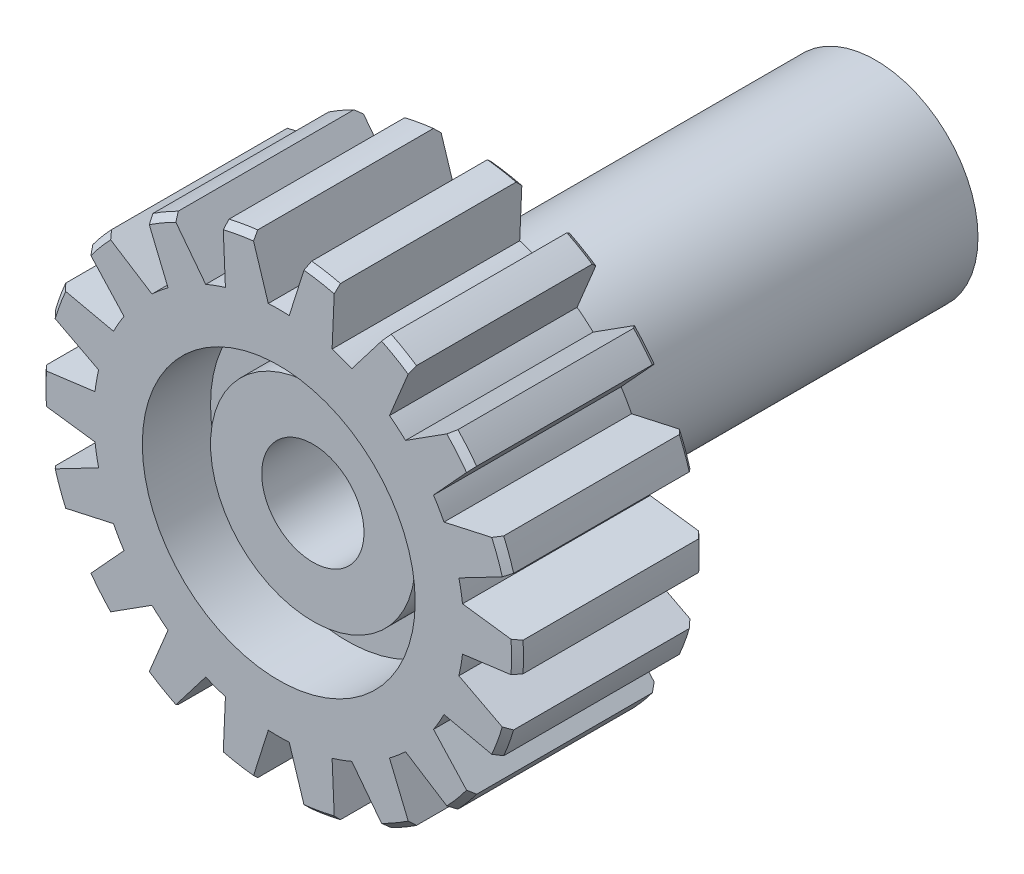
SolidWorks part; units mm, degrees
ref_plane "Plan1" through (0, 0, 0) normal (0, 0, 1) x (1, 0, 0)
ref_plane "Plan2" through (0, 0, 0) normal (0, 1, 0) x (1, 0, 0)
ref_plane "Plan3" through (0, 0, 0) normal (1, 0, 0) x (0, 0, -1)
sketch "Diamètre primitif" plane through (0, 0, 0) normal (0, 0, 1) x (1, 0, 0)
  line L0 (0, 0) -> (0.7, 0) construction
  circle A0 centre (0, 0) radius 6.3
  point P3 (0, 0)
  dimension "D1" = 12.6
  dimension "D2" = 0.7
sketch "Esquisse2" plane through (0, 0, 0) normal (0, 0, 1) x (1, 0, 0)
  circle A0 centre (0, 0) radius 7
  dimension "D1" = 14
extrude "Diamètre de tête" add sketch "Esquisse2" along normal mid plane 5.5
chamfer "Chanfreins" distance 0.175 angle 45
sketch "Esquisse3" plane through (0, 0, 0) normal (0, 0, 1) x (1, 0, 0)
  line L0 (0, 0) -> (0, 7) construction
  line L1 (-0.3072, 5.4163) -> (-0.7924, 6.955)
  line L2 (0.3072, 5.4163) -> (0.7924, 6.955)
  arc A0 (0.3072, 5.4163) -> (-0.3072, 5.4163) centre (0, 0) ccw
  circle A1 centre (0, 0) radius 7 construction
  arc A2 (0.7924, 6.955) -> (-0.7924, 6.955) centre (0, 0) ccw
  point P1 (-0.5498, 6.1857)
  point P10 (0.5498, 6.1857)
  dimension "D1" = 10.85
  dimension "D2" = 1.0996
  dimension "D3" = 325
extrude "Creux dent" cut sketch "Esquisse3" against normal through all and the other way through all
pattern_circular "Répétition" count 18 over 360
sketch "Esquisse6" plane through (0, 0, -2.75) normal (0, 0, -1) x (-1, 0, 0)
  circle A0 centre (0, 0) radius 3
  dimension "D1" = 6
extrude "Bossage arrière" add sketch "Esquisse6" along normal blind 12
sketch "Esquisse4" plane through (0, 0, 2.75) normal (0, 0, 1) x (1, 0, 0)
  circle A0 centre (0, 0) radius 1.5
  dimension "D1" = 3
extrude "Passage axe" cut sketch "Esquisse4" against normal blind 5.5
sketch "Esquisse5" plane through (0, 0, 2.75) normal (0, 0, 1) x (1, 0, 0)
  circle A0 centre (0, 0) radius 3
  dimension "D1" = 6
extrude "Gorge" cut sketch "Esquisse5" against normal blind 2 thin
sketch "Esquisse7" plane through (0, 0, 2.75) normal (0, 0, 1) x (1, 0, 0)
  circle A1 centre (0, 0) radius 3
  circle A2 centre (0, 0) radius 3
  dimension "D1" = 0
extrude "Rabotage bossage" cut sketch "Esquisse7" against normal blind 1
sketch "Esquisse8" plane through (0, 0, -14.75) normal (0, 0, -1) x (-1, 0, 0)
  line L1 (1.5, -0.866) -> (1.5, 0.866)
  line L2 (1.5, 0.866) -> (0, 1.7321)
  line L3 (0, 1.7321) -> (-1.5, 0.866)
  line L4 (-1.5, 0.866) -> (-1.5, -0.866)
  line L5 (-1.5, -0.866) -> (0, -1.7321)
  line L6 (0, -1.7321) -> (1.5, -0.866)
  circle A0 centre (0, 0) radius 1.5 construction
  dimension "D1" = 3
extrude "Hexagone" cut sketch "Esquisse8" against normal blind 7
equation "\"D1@Esquisse2\" = \"D1@Diamètre primitif\" + 2 * \"D2@Diamètre primitif\""
equation "\"D1@Chanfreins\" = 0.25*\"D2@Diamètre primitif\""
equation "\"D1@Esquisse3\" = \"D1@Diamètre primitif\"-2.5*\"D2@Diamètre primitif\""
equation "\"D2@Esquisse3\"=3.14159*\"D2@Diamètre primitif\"/2"
equation "\"D1@Répétition\" = \"D1@Diamètre primitif\"/\"D2@Diamètre primitif\""
